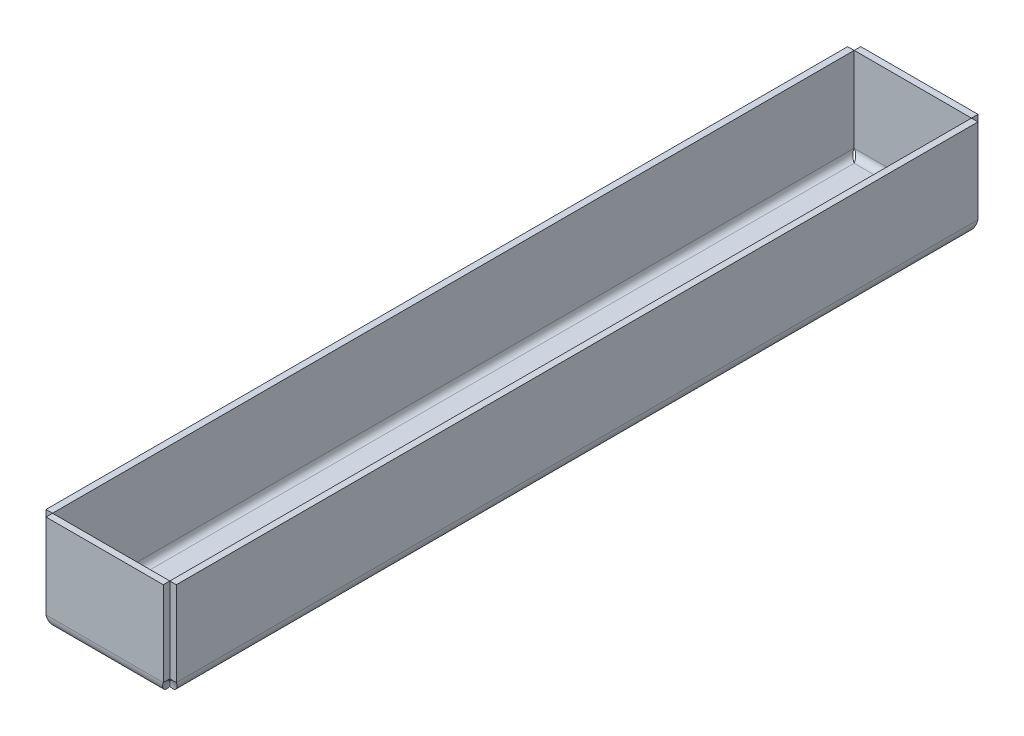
SolidWorks part; units mm, degrees
ref_plane "Ebene vorne" through (0, 0, 0) normal (0, 0, 1) x (1, 0, 0)
ref_plane "Ebene oben" through (0, 0, 0) normal (0, 1, 0) x (1, 0, 0)
ref_plane "Ebene rechts" through (0, 0, 0) normal (1, 0, 0) x (0, 0, -1)
sketch "Skizze1" plane through (0, 0, 0) normal (0, 0, 1) x (1, 0, 0)
  line L0 (0, 0) -> (-43.8943, 0) construction
  line L1 (0, 0) -> (0, 25.2585) construction
  line L3 (-20, 15) -> (20, 15)
  line L4 (-20, 15) -> (-20, -15)
  line L5 (-20, -15) -> (20, -15)
  line L6 (20, 15) -> (20, -15)
  dimension "D1" = 40
  dimension "D2" = 30
extrude "Linear austragen1" add sketch "Skizze1" along normal mid plane 250
shell "Wandung1" thickness 2
other "Bohrung2" parameters "Dicke"=2
sketch "Skizze3" plane through (0, -13, 0) normal (0, 1, 0) x (-1, 0, 0)
  circle A0 centre (0, 0) radius 5.25
  dimension "D1" = 10.5
pattern_linear "Lineares Muster1" count 3 spacing 55 along (0, 0, -1) count 3 spacing 55 along (0, 0, 1) of "Bohrung2"
rip "Schlitz1"
sheet metal parameters "Blech1" parameters "D1"=2
bend "Biegung-Winkel4" parameters "D1"=0
flatten bends "Abwickeln1" parameters "D1"=0, "D4"=90, "D5"=4
sketch "Skizze-Winkel1" plane through (0, -13, 0) normal (0, 1, 0) x (-1, 0, 0)
  line L0 (18.3562, -122.99) -> (18.3562, 122.99) construction
  line L1 (-18.3562, 122.99) -> (-18.3562, -122.99) construction
  line L2 (17.99, 123.3562) -> (-17.99, 123.3562) construction
  line L3 (-17.99, -123.3562) -> (17.99, -123.3562) construction
bend "Biegung-Winkel1" bend angle 90 parameters "D1"=0, "D5"=1
bend "Biegung-Winkel2" bend angle 90 parameters "D1"=0, "D5"=2
bend "Biegung-Winkel3" bend angle 90 parameters "D1"=0, "D5"=3
process bends "Abbiegen1" parameters "D1"=0
sketch "Abwicklung-Skizze1" plane through (0, -13, 0) normal (0, 1, 0) x (-1, 0, 0)
flat pattern "Abwicklung2"
sketch "Biegung-Linien2" plane through (0, -13, 0) normal (0, 1, 0) x (-1, 0, 0)
  line L0 (18.3562, 121.995) -> (18.3562, -121.995) construction
  line L1 (-18.3562, -121.995) -> (-18.3562, 121.995) construction
  line L2 (16.995, 123.3562) -> (-16.995, 123.3562) construction
  line L3 (-16.995, -123.3562) -> (16.995, -123.3562) construction
bend of the flat pattern "Abwickeln-<Biegung-Winkel1>2"
bend of the flat pattern "Abwickeln-<Biegung-Winkel2>2"
bend of the flat pattern "Abwickeln-<Biegung-Winkel3>2"
bend of the flat pattern "Abwickeln-<Biegung-Winkel4>2"
